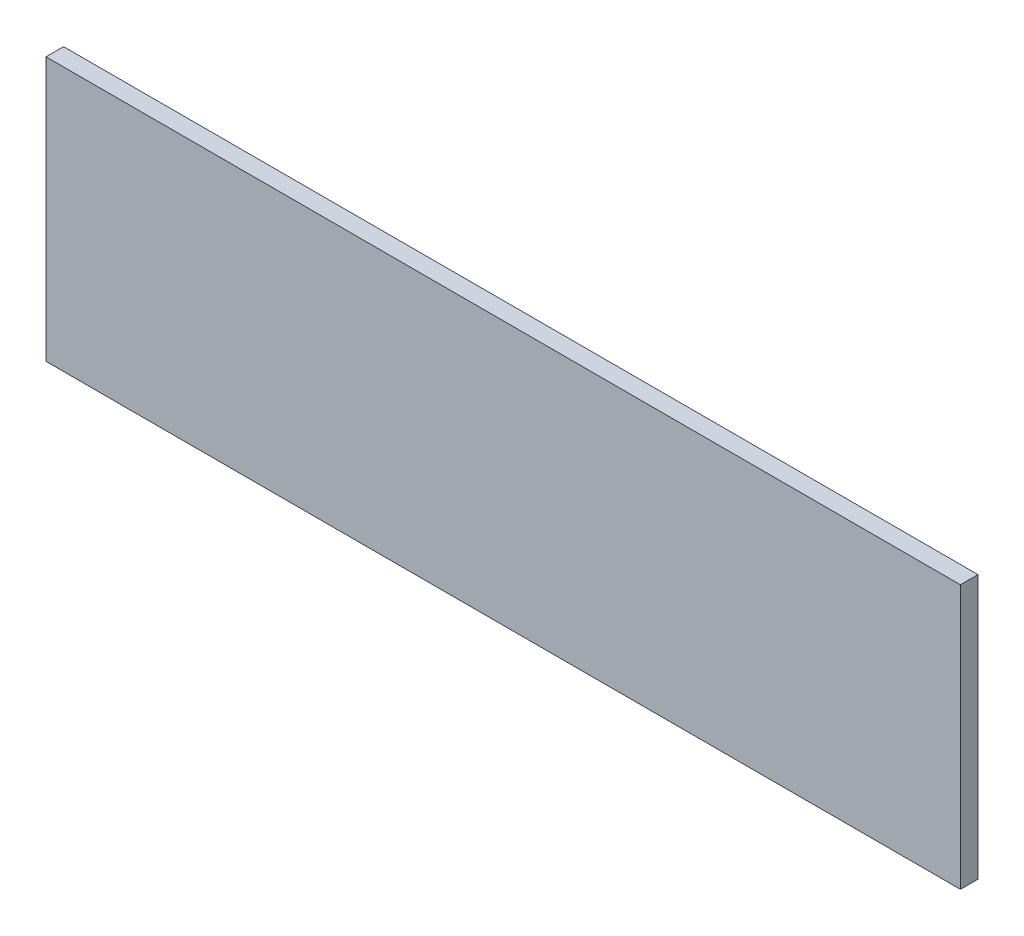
SolidWorks part; units mm, degrees
ref_plane "Front Plane" through (0, 0, 0) normal (0, 0, 1) x (1, 0, 0)
ref_plane "Top Plane" through (0, 0, 0) normal (0, 1, 0) x (1, 0, 0)
ref_plane "Right Plane" through (0, 0, 0) normal (1, 0, 0) x (0, 0, -1)
sketch "Sketch1" plane through (0, 0, 0) normal (0, 0, 1) x (1, 0, 0)
  line L1 (0, 0) -> (82.55, 0)
  line L2 (0, 0) -> (0, 23.8125)
  line L3 (0, 23.8125) -> (82.55, 23.8125)
  line L4 (82.55, 0) -> (82.55, 23.8125)
  dimension "D1" = 82.55
  dimension "D2" = 23.8125
extrude "Boss-Extrude1" add sketch "Sketch1" along normal blind 1.5875
